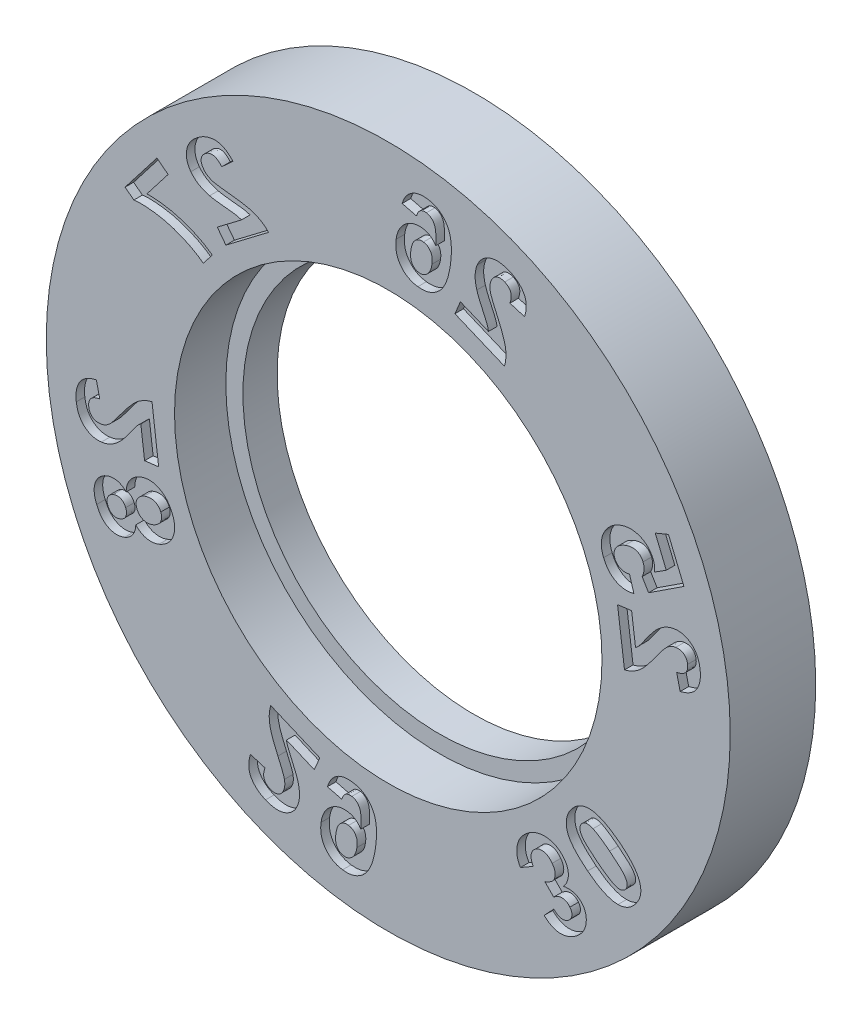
SolidWorks part; units mm, degrees
ref_plane "Front Plane" through (0, 0, 0) normal (0, 0, 1) x (1, 0, 0)
ref_plane "Top Plane" through (0, 0, 0) normal (0, 1, 0) x (1, 0, 0)
ref_plane "Right Plane" through (0, 0, 0) normal (1, 0, 0) x (0, 0, -1)
imported_body "Imported1"
other "DeleteFace2"
sketch "Sketch2" plane through (0, 0, 0) normal (0, 0, 1) x (1, 0, 0)
  line L2 (0, 0) -> (0, 21.375) construction
  line L3 (0, 0) -> (18.5113, 10.6875) construction
  line L4 (0, 0) -> (18.5113, -10.6875) construction
  line L5 (0, 0) -> (0, -21.375) construction
  line L6 (0, 0) -> (-18.5113, -10.6875) construction
  line L7 (0, 0) -> (-18.5113, 10.6875) construction
  circle A0 centre (0, 0) radius 13.8372 construction
  text T0 "25    26    27    28    29    30" font "Arial" height 4.7
  point P11 (0, 0)
  dimension "D1" = 6
extrude "Cut-Extrude1" cut sketch "Sketch2" against normal blind 0.5
